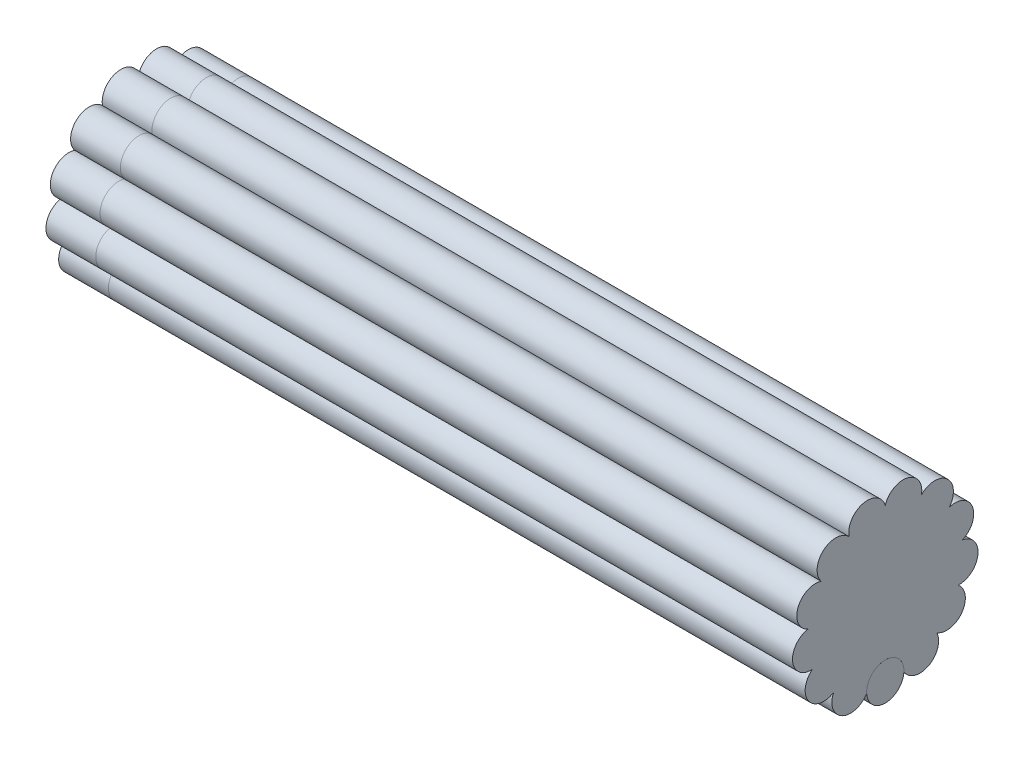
SolidWorks part; units mm, degrees
ref_plane "Alzado" through (0, 0, 0) normal (0, 0, 1) x (1, 0, 0)
ref_plane "Planta" through (0, 0, 0) normal (0, 1, 0) x (1, 0, 0)
ref_plane "Vista lateral" through (0, 0, 0) normal (1, 0, 0) x (0, 0, -1)
sketch "Croquis2" plane through (0, 0, 0) normal (1, 0, 0) x (0, 0, -1)
  circle A0 centre (0, 0) radius 30 construction
  circle A1 centre (0, 0) radius 37.5 construction
  arc A2 (7.49, -30.388) -> (-7.49, -30.388) centre (0, -30) ccw
  circle A3 centre (0, 0) radius 30 construction
  arc A4 (-20.754, -23.4264) -> (-7.49, -30.388) centre (-13.9417, -26.5637) ccw
  circle A5 centre (0, 0) radius 30 construction
  circle A7 centre (0, 0) radius 30 construction
  arc A8 (-31.0692, 3.7725) -> (-29.2636, -11.0982) centre (-29.7813, -3.6161) ccw
  circle A9 centre (0, 0) radius 30 construction
  arc A10 (-25.7573, 17.779) -> (-31.0692, 3.7725) centre (-28.0505, 10.6381) ccw
  circle A11 centre (0, 0) radius 30 construction
  arc A12 (-14.5446, 27.7125) -> (-25.7573, 17.779) centre (-19.8937, 22.4553) ccw
  circle A13 centre (0, 0) radius 30 construction
  arc A14 (0, 31.2974) -> (-14.5446, 27.7125) centre (-7.1795, 29.1283) ccw
  circle A15 centre (0, 0) radius 30 construction
  arc A16 (14.5446, 27.7125) -> (0, 31.2974) centre (7.1795, 29.1283) ccw
  circle A17 centre (0, 0) radius 30 construction
  circle A19 centre (0, 0) radius 30 construction
  arc A20 (31.0692, 3.7725) -> (25.7573, 17.779) centre (28.0505, 10.6381) ccw
  circle A21 centre (0, 0) radius 30 construction
  circle A23 centre (0, 0) radius 30 construction
  circle A25 centre (0, 0) radius 30 construction
  arc A27 (25.7573, 17.779) -> (14.5446, 27.7125) centre (19.8937, 22.4553) ccw
  arc A28 (22.1869, 15.3145) -> (24.8418, 16.8192) centre (19.8937, 22.4553) ccw
  arc A29 (29.2636, -11.0982) -> (31.0692, 3.7725) centre (29.7813, -3.6161) ccw
  arc A30 (20.754, -23.4264) -> (29.2636, -11.0982) centre (24.6895, -17.0419) ccw
  arc A31 (25.2072, -9.5598) -> (27.9537, -10.89) centre (29.7813, -3.6161) ccw
  arc A33 (17.8772, -20.1792) -> (19.6909, -22.6333) centre (24.6895, -17.0419) ccw
  arc A34 (20.0949, -22.2755) -> (17.8772, -20.1792) centre (13.9417, -26.5637) ccw
  arc A35 (7.49, -30.388) -> (20.754, -23.4264) centre (13.9417, -26.5637) ccw
  arc A36 (-29.2636, -11.0982) -> (-20.754, -23.4264) centre (-24.6895, -17.0419) ccw
  arc A37 (-25.2072, -9.5598) -> (-28.145, -10.3854) centre (-24.6895, -17.0419) ccw
  point P45 (0, 0)
  dimension "D1" = 60
  dimension "D2" = 75
  dimension "D3" = 13
extrude "Saliente-Extruir1" add sketch "Croquis2" against normal blind 280
sketch "Croquis3" plane through (0, 0, 0) normal (1, 0, 0) x (0, 0, -1)
  circle A0 centre (0, -30) radius 7.5
  dimension "D1" = 15
extrude "Saliente-Extruir2" add sketch "Croquis3" against normal blind 280 separate body
sketch "Croquis4" plane through (-280, 0, 0) normal (-1, 0, 0) x (0, 0, 1)
  circle A1 centre (0, -30) radius 7.5
  arc A2 (-7.49, -30.388) -> (7.49, -30.388) centre (0, -30) ccw
  arc A13 (7.49, -30.388) -> (20.754, -23.4264) centre (13.9417, -26.5637) ccw
  arc A14 (20.754, -23.4264) -> (29.2636, -11.0982) centre (24.6895, -17.0419) ccw
  arc A15 (29.2636, -11.0982) -> (31.0692, 3.7725) centre (29.7813, -3.6161) ccw
  arc A16 (31.0692, 3.7725) -> (25.7573, 17.779) centre (28.0505, 10.6381) ccw
  arc A17 (25.7573, 17.779) -> (14.5446, 27.7125) centre (19.8937, 22.4553) ccw
  arc A18 (14.5446, 27.7125) -> (0, 31.2974) centre (7.1795, 29.1283) ccw
  arc A19 (0, 31.2974) -> (-14.5446, 27.7125) centre (-7.1795, 29.1283) ccw
  arc A20 (-14.5446, 27.7125) -> (-25.7573, 17.779) centre (-19.8937, 22.4553) ccw
  arc A21 (-25.7573, 17.779) -> (-31.0692, 3.7725) centre (-28.0505, 10.6381) ccw
  arc A22 (-31.0692, 3.7725) -> (-29.2636, -11.0982) centre (-29.7813, -3.6161) ccw
  arc A23 (-29.2636, -11.0982) -> (-20.754, -23.4264) centre (-24.6895, -17.0419) ccw
  arc A24 (-20.754, -23.4264) -> (-7.49, -30.388) centre (-13.9417, -26.5637) ccw
  arc A25 (7.49, -30.388) -> (-7.49, -30.388) centre (0, -30) ccw
  arc A26 (7.49, -30.388) -> (20.754, -23.4264) centre (13.9417, -26.5637) ccw
  arc A27 (20.754, -23.4264) -> (29.2636, -11.0982) centre (24.6895, -17.0419) ccw
  arc A28 (29.2636, -11.0982) -> (31.0692, 3.7725) centre (29.7813, -3.6161) ccw
  arc A29 (31.0692, 3.7725) -> (25.7573, 17.779) centre (28.0505, 10.6381) ccw
  arc A30 (25.7573, 17.779) -> (14.5446, 27.7125) centre (19.8937, 22.4553) ccw
  arc A31 (14.5446, 27.7125) -> (0, 31.2974) centre (7.1795, 29.1283) ccw
  arc A32 (0, 31.2974) -> (-14.5446, 27.7125) centre (-7.1795, 29.1283) ccw
  arc A33 (-14.5446, 27.7125) -> (-25.7573, 17.779) centre (-19.8937, 22.4553) ccw
  arc A34 (-25.7573, 17.779) -> (-31.0692, 3.7725) centre (-28.0505, 10.6381) ccw
  arc A35 (-31.0692, 3.7725) -> (-29.2636, -11.0982) centre (-29.7813, -3.6161) ccw
  arc A36 (-29.2636, -11.0982) -> (-20.754, -23.4264) centre (-24.6895, -17.0419) ccw
  arc A37 (-20.754, -23.4264) -> (-7.49, -30.388) centre (-13.9417, -26.5637) ccw
  dimension "D1" = 0
  dimension "D2" = 0
extrude "Saliente-Extruir3" add sketch "Croquis4" along normal blind 20 separate body
sketch "Croquis5" plane through (0, 0, 0) normal (1, 0, 0) x (0, 0, -1)
  circle A0 centre (0, 0) radius 15
  dimension "D1" = 30
